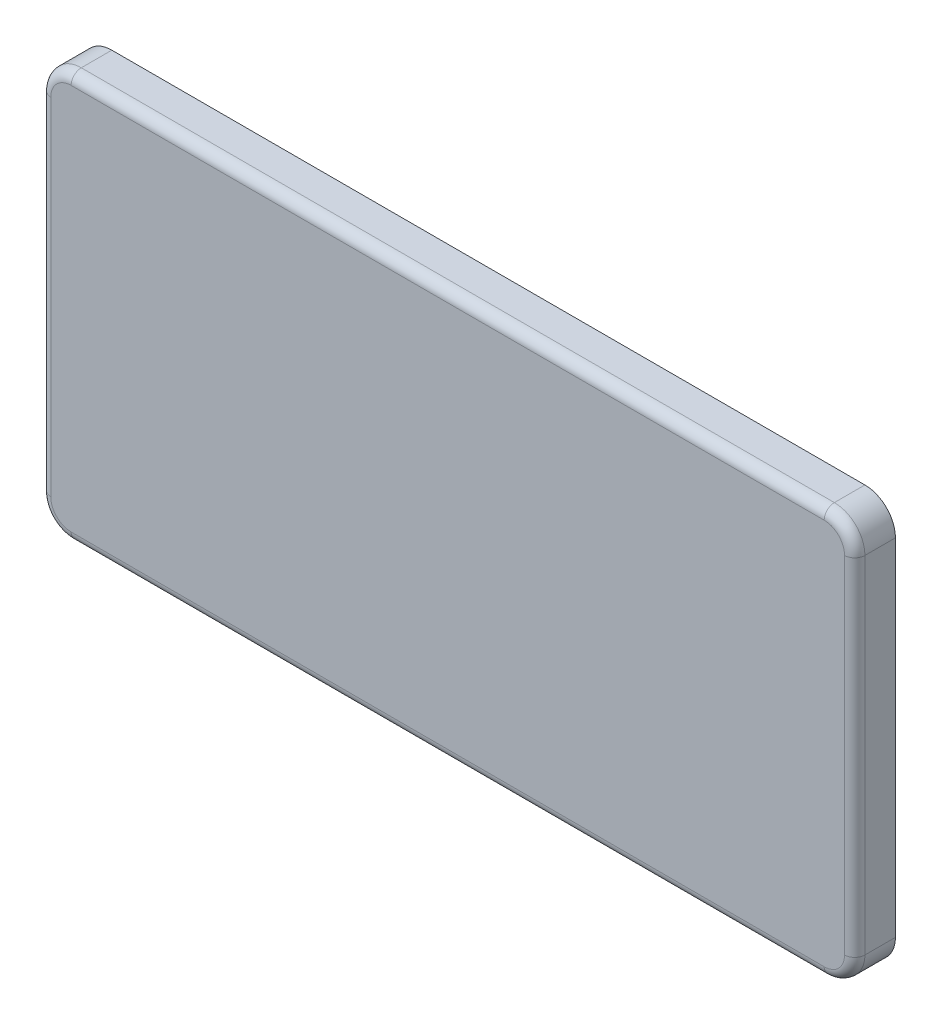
SolidWorks part; units mm, degrees
ref_plane "Alzado" through (0, 0, 0) normal (0, 0, 1) x (1, 0, 0)
ref_plane "Planta" through (0, 0, 0) normal (0, 1, 0) x (1, 0, 0)
ref_plane "Vista lateral" through (0, 0, 0) normal (1, 0, 0) x (0, 0, -1)
sketch "Croquis1" plane through (0, 0, 0) normal (0, 0, 1) x (1, 0, 0)
  line L0 (-17, 20) -> (57, 20)
  line L1 (60, 17) -> (60, -17)
  line L2 (57, -20) -> (-17, -20)
  line L3 (-20, -17) -> (-20, 17)
  arc A1 (57, -20) -> (60, -17) centre (57, -17) ccw
  arc A3 (60, 17) -> (57, 20) centre (57, 17) ccw
  arc A6 (-20, 17) -> (-17, 20) centre (-17, 17) cw
  arc A7 (-17, -20) -> (-20, -17) centre (-17, -17) cw
extrude "Extruir5" add sketch "Croquis1" along normal blind 4
fillet "Redondeo1" radius 1 8 edges at (20, -20, 4) (-19.1213, -19.1213, 4) (-20, 0, 4) (-19.1213, 19.1213, 4) (20, 20, 4) (59.1213, 19.1213, 4) (60, 0, 4) (59.1213, -19.1213, 4)
